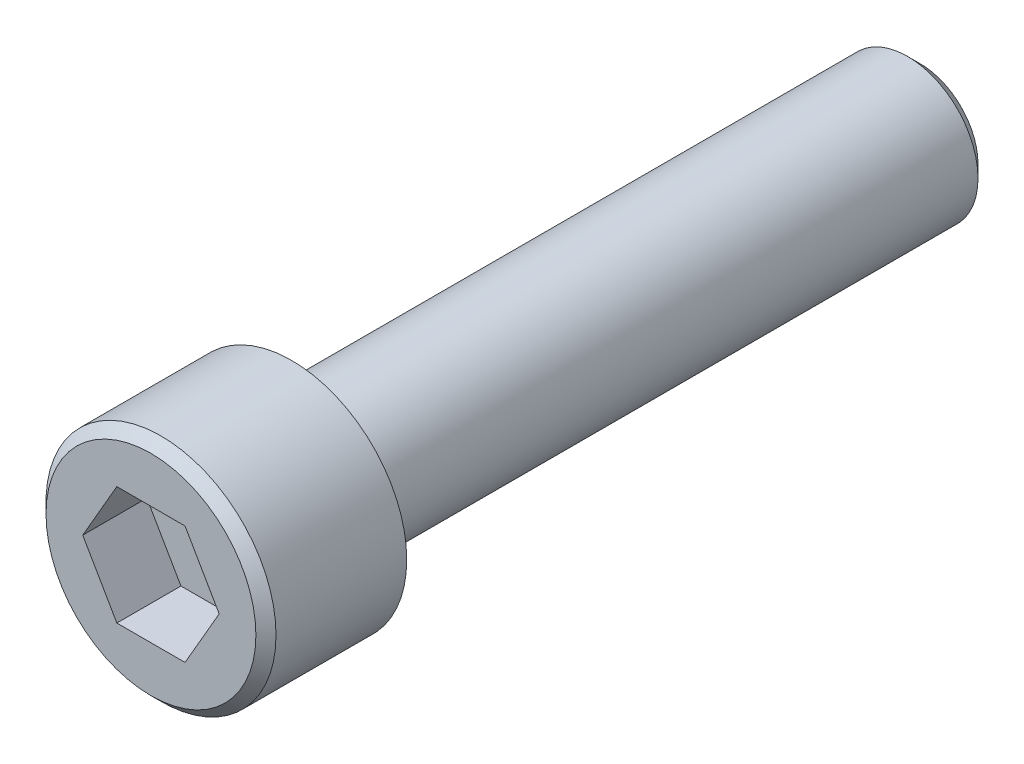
SolidWorks part; units mm, degrees
ref_plane "Plane1" through (0, 0, 0) normal (0, 0, 1) x (1, 0, 0)
ref_plane "Plane2" through (0, 0, 0) normal (0, 1, 0) x (1, 0, 0)
ref_plane "Plane3" through (0, 0, 0) normal (1, 0, 0) x (0, 0, -1)
sketch "Sketch1" plane through (0, 0, 0) normal (0, 0, 1) x (1, 0, 0)
  circle A0 centre (0, 0) radius 2.3241
  dimension "Head Dia." = 4.6482
extrude "Head" add sketch "Sketch1" against normal blind 2.8448
sketch "Sketch2" plane through (0, 0, -2.8448) normal (0, 0, -1) x (-1, 0, 0)
  circle A0 centre (0, 0) radius 1.4224
  dimension "Shaft O.D." = 2.8448
extrude "Shank" add sketch "Sketch2" along normal blind 12.7
sketch "Sketch3" plane through (0, 0, 0) normal (0, 0, 1) x (1, 0, 0)
  line L1 (1.3785, 0) -> (0.6892, 1.1938)
  line L2 (0.6892, 1.1938) -> (-0.6892, 1.1938)
  line L3 (-0.6892, 1.1938) -> (-1.3785, 0)
  line L4 (-1.3785, 0) -> (-0.6892, -1.1938)
  line L5 (-0.6892, -1.1938) -> (0.6892, -1.1938)
  line L6 (0.6892, -1.1938) -> (1.3785, 0)
  circle A0 centre (0, 0) radius 1.1938 construction
  dimension "Socket Size" = 2.3876
extrude "Socket" cut sketch "Sketch3" against normal blind 1.2954
chamfer "Bottom Chamfer" distance 0.254 angle 45 1 edges at (-1.4224, 0, -15.5448)
chamfer "Top Chamfer" distance 0.2032 angle 45 1 edges at (2.3241, 0, 0)
sketch "Sketch4" plane through (0, 0, -15.5448) normal (0, 0, -1) x (-1, 0, 0)
  circle A0 centre (0, 0) radius 0.3937
  dimension "D1" = 0.7874
extrude "Cut-Extrude1" cut sketch "Sketch4" against normal through all
